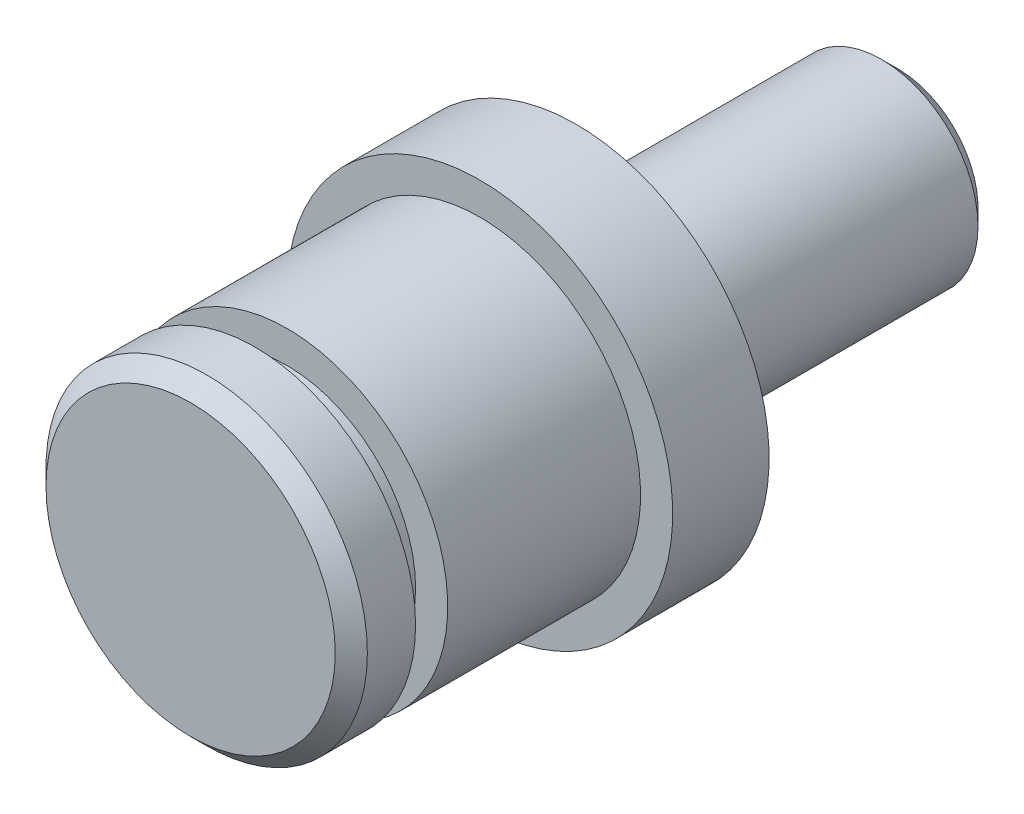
SolidWorks part; units mm, degrees
ref_plane "Plan de face" through (0, 0, 0) normal (0, 0, 1) x (1, 0, 0)
ref_plane "Plan de dessus" through (0, 0, 0) normal (0, 1, 0) x (1, 0, 0)
ref_plane "Plan de droite" through (0, 0, 0) normal (1, 0, 0) x (0, 0, -1)
sketch "Esquisse1" plane through (0, 0, 0) normal (0, 0, 1) x (1, 0, 0)
  circle A0 centre (0, 0) radius 5
  dimension "D1" = 10
extrude "Boss.-Extru.1" add sketch "Esquisse1" along normal blind 2
sketch "Esquisse2" plane through (0, 0, 0) normal (0, 0, -1) x (-1, 0, 0)
  circle A0 centre (0, 0) radius 4
  dimension "D1" = 8
extrude "Boss.-Extru.2" add sketch "Esquisse2" along normal blind 1
sketch "Esquisse3" plane through (0, 0, -1) normal (0, 0, -1) x (-1, 0, 0)
  circle A0 centre (0, 0) radius 5
  dimension "D1" = 10
extrude "Boss.-Extru.3" add sketch "Esquisse3" along normal blind 6
sketch "Esquisse4" plane through (0, 0, -7) normal (0, 0, -1) x (-1, 0, 0)
  circle A0 centre (0, 0) radius 6
  dimension "D1" = 12
extrude "Boss.-Extru.4" add sketch "Esquisse4" along normal blind 3
sketch "Esquisse5" plane through (0, 0, -10) normal (0, 0, -1) x (-1, 0, 0)
  circle A0 centre (0, 0) radius 3
  dimension "D1" = 6
extrude "Boss.-Extru.5" add sketch "Esquisse5" along normal blind 10
chamfer "Chanfrein1" distance 0.5 angle 45 1 edges at (5, 0, 2)
chamfer "Chanfrein2" distance 0.5 angle 45 1 edges at (-3, 0, -20)
sketch "Esquisse6" plane through (0, 0, 0) normal (0, 1, 0) x (1, 0, 0)
  line L0 (3, 10) -> (3, 19.5) construction
  line L1 (0, 0) -> (0, 22.9421) construction
  line L3 (5, 0) -> (-5, 0) construction
  circle A0 centre (3, 10.5) radius 0.5
  dimension "D1" = 1
revolve "Enlèvement de matière-Révolution1" cut sketch "Esquisse6" angle 360 about L1
